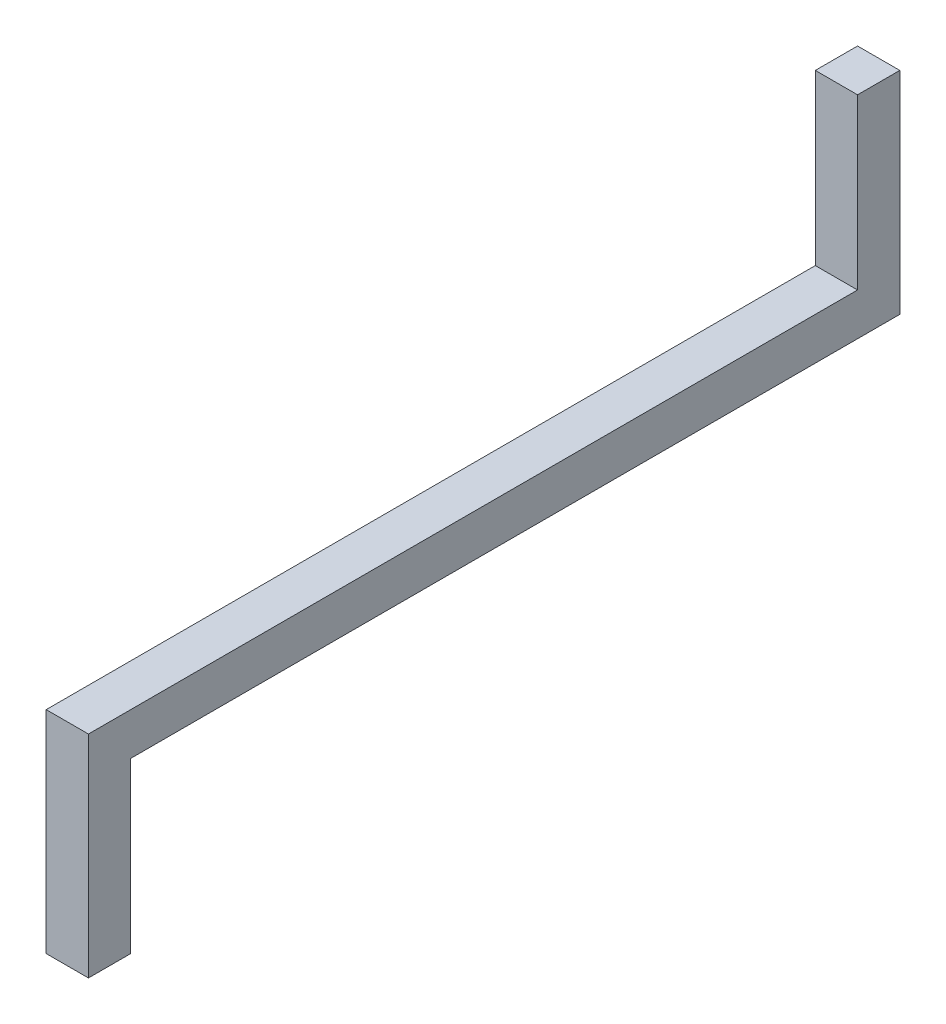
SolidWorks part; units mm, degrees
ref_plane "Front Plane" through (0, 0, 0) normal (0, 0, 1) x (1, 0, 0)
ref_plane "Top Plane" through (0, 0, 0) normal (0, 1, 0) x (1, 0, 0)
ref_plane "Right Plane" through (0, 0, 0) normal (1, 0, 0) x (0, 0, -1)
sketch "Sketch1" plane through (0, 0, 0) normal (1, 0, 0) x (0, 0, -1)
  line L0 (0, 0) -> (-3.175, 0)
  line L1 (0, 0) -> (0, 12.7)
  line L2 (-3.175, 0) -> (-3.175, 15.875)
  line L3 (-3.175, 15.875) -> (54.61, 15.875)
  line L4 (57.785, 15.875) -> (57.785, 12.7)
  line L5 (57.785, 12.7) -> (0, 12.7)
  line L6 (57.785, 15.875) -> (57.785, 19.2425)
  line L7 (54.61, 15.875) -> (54.61, 28.575)
  line L8 (54.61, 28.575) -> (57.785, 28.575)
  line L9 (57.785, 28.575) -> (57.785, 19.2425)
extrude "Boss-Extrude1" add sketch "Sketch1" along normal blind 3.175
